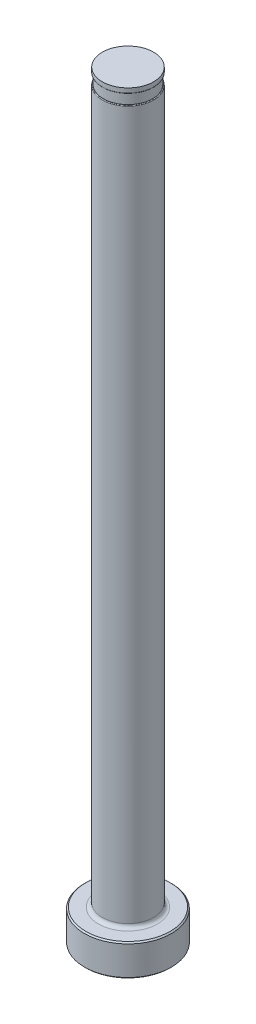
SolidWorks part; units mm, degrees
ref_plane "Front Plane" through (0, 0, 0) normal (0, 0, 1) x (1, 0, 0)
ref_plane "Top Plane" through (0, 0, 0) normal (0, 1, 0) x (1, 0, 0)
ref_plane "Right Plane" through (0, 0, 0) normal (1, 0, 0) x (0, 0, -1)
other "Configuration Table"
sketch "Sketch1" plane through (0, 0, 0) normal (0, 0, 1) x (1, 0, 0)
  line L0 (0, 259.9588) -> (0, -15.1925) construction
  line L1 (0, 0) -> (-8.7249, 0)
  line L2 (-8.7249, 0) -> (-8.7249, 6.35)
  line L3 (-8.7249, 6.35) -> (-5.1587, 6.35)
  line L4 (-5.1587, 6.35) -> (-5.1587, 152.4)
  line L5 (-5.1587, 152.4) -> (0, 152.4)
  line L6 (0, 152.4) -> (0, 0)
  dimension "L" = 152.4
  dimension "H" = 17.4498
  dimension "T" = 6.35
  dimension "D" = 10.3175
revolve "Revolve1" add sketch "Sketch1" angle 360 about L0
chamfer "Chamfer1" distance 0.254 angle 45 2 edges at (0, 6.35, 8.7249) (0, 0, 8.7249)
fillet "Fillet1" radius 0.762 1 edges at (0, 6.35, 5.1587)
sketch "Sketch2" plane through (0, 0, 0) normal (0, 0, 1) x (1, 0, 0)
  line L0 (-5.1587, 152.4) -> (-5.1587, 7.112) construction
  line L1 (-5.1587, 151.384) -> (-4.9555, 151.384)
  line L2 (-5.1587, 151.384) -> (-5.1587, 149.352)
  line L3 (-5.1587, 149.352) -> (-4.9555, 149.352)
  line L4 (-4.9555, 151.384) -> (-4.9555, 149.352)
  line L5 (5.1587, 152.4) -> (-5.1587, 152.4) construction
  line L6 (0, 153.4483) -> (0, 147.3282) construction
  dimension "D1" = 2.032
  dimension "N" = 1.016
  dimension "FD" = 0.2032
  dimension "D3" = 9.9111
revolve "Vent Relief" cut sketch "Sketch2" angle 360 about L6
sketch "Sketch3" plane through (0, 0, 0) normal (0, 0, 1) x (1, 0, 0)
  line L0 (-4.9555, 150.368) -> (-4.9555, 86.868)
  line L1 (-4.9555, 151.384) -> (-4.9555, 149.352) construction
  line L2 (-5.1587, 149.352) -> (-5.1587, 7.112) construction
  line L3 (-5.1587, 85.7504) -> (-5.1587, 150.368)
  line L4 (-5.1587, 150.368) -> (-4.9555, 150.368)
  arc A0 (-4.9555, 86.868) -> (-5.1587, 85.7504) centre (-8.1305, 86.868) cw
  dimension "D1" = 3.175
  dimension "D2" = 63.5
extrude "D-Slot" cut sketch "Sketch3" against normal through all both and the other way through all
sketch "Sketch5" plane through (0, 0, 0) normal (0, 0, 1) x (1, 0, 0)
  line L0 (-5.1587, 151.384) -> (5.1587, 151.384) construction
  line L1 (-5.1587, 152.4) -> (-5.1537, 152.4)
  line L2 (-5.1587, 152.4) -> (-5.1587, 151.384)
  line L3 (-5.1587, 151.384) -> (-5.1537, 151.384)
  line L4 (-5.1537, 152.4) -> (-5.1537, 151.384)
  line L5 (0, 152.6877) -> (0, 150.5771) construction
  dimension "VP" = 0.0051
revolve "Vent Diameter" cut sketch "Sketch5" angle 360 about L5
fillet "Fillet2" radius 0.127 2 edges at (5.1587, 149.352, 0) (0, 151.384, 5.1537)
sketch "Pocket Sketch" plane through (0, 0, 0) normal (0, 0, 1) x (1, 0, 0)
  line L0 (-9.1218, 0) -> (-9.1218, 6.3754)
  line L1 (-9.1218, 6.3754) -> (-6.1192, 6.3754)
  line L2 (-5.3572, 7.1374) -> (-5.3572, 22.225)
  line L3 (-5.3572, 22.225) -> (0, 22.225)
  line L4 (0, 22.225) -> (0, 0)
  line L5 (0, 0) -> (-9.1218, 0)
  line L6 (0, 12.6104) -> (0, -2.4989) construction
  line L7 (-8.7249, 6.096) -> (-8.7249, 0.254) construction
  line L8 (8.4709, 6.35) -> (-8.4709, 6.35) construction
  line L9 (-5.1587, 85.7504) -> (-5.1587, 7.112) construction
  line L10 (-6.1192, 6.3754) -> (-5.3572, 7.1374)
  point P3 (-5.3572, 6.3754)
  dimension "D1" = 18.2435
  dimension "D2" = 0.3969
  dimension "D3" = 0.0254
  dimension "D4" = 0.1984
  dimension "D5" = 10.7144
  dimension "D6" = 22.225
